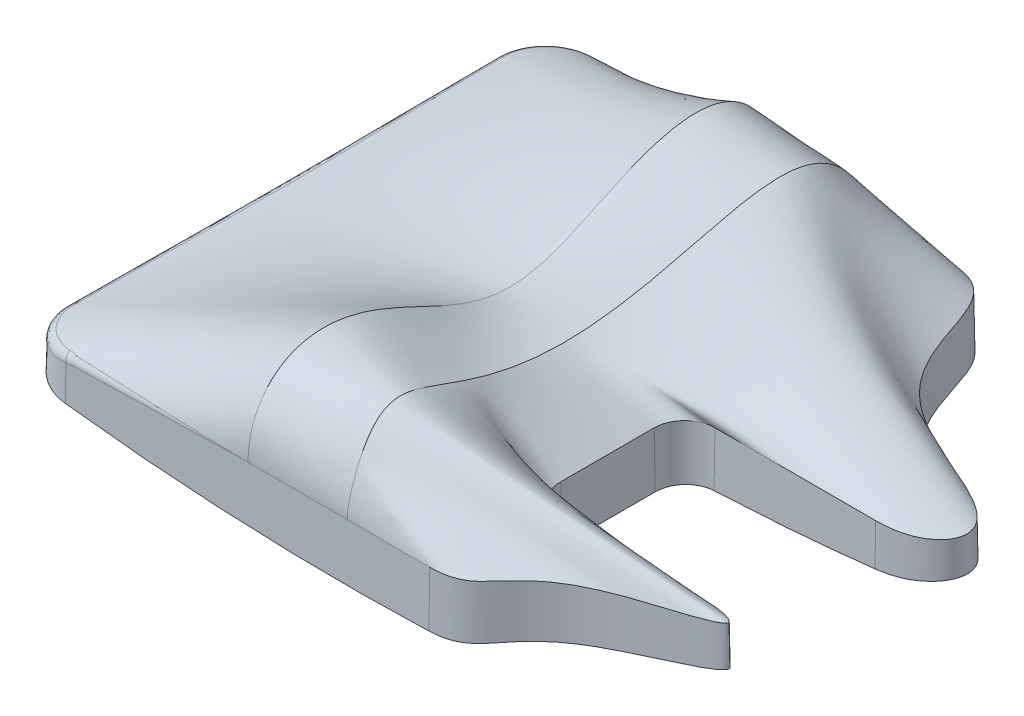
SolidWorks part; units mm, degrees
ref_plane "Front Plane" through (0, 0, 0) normal (0, 0, 1) x (1, 0, 0)
ref_plane "Top Plane" through (0, 0, 0) normal (0, 1, 0) x (1, 0, 0)
ref_plane "Right Plane" through (0, 0, 0) normal (1, 0, 0) x (0, 0, -1)
body saved out of another part "Stock-Part1_version4-1"
